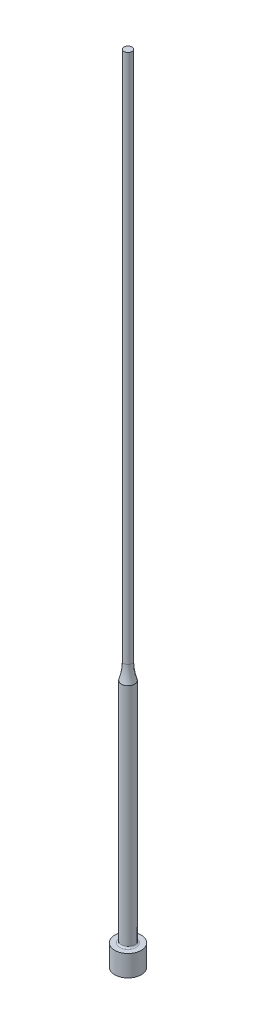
SolidWorks part; units mm, degrees
ref_plane "Front Plane" through (0, 0, 0) normal (0, 0, 1) x (1, 0, 0)
ref_plane "Top Plane" through (0, 0, 0) normal (0, 1, 0) x (1, 0, 0)
ref_plane "Right Plane" through (0, 0, 0) normal (1, 0, 0) x (0, 0, -1)
sketch "Sketch1" plane through (0, 0, 0) normal (0, 0, 1) x (1, 0, 0)
  line L0 (0, 0) -> (2.5, 0)
  line L1 (55, 0) -> (-55, 0) construction
  line L2 (2.5, 0) -> (2.5, 4)
  line L3 (2.5, 4) -> (1.55, 4)
  line L4 (1.25, 4.3) -> (1.25, 46.8775)
  line L6 (0.75, 50) -> (0.75, 150)
  line L7 (0.75, 150) -> (0, 150)
  line L8 (0, 150) -> (0, 0)
  arc A0 (0.75, 50) -> (1.25, 46.8775) centre (10.75, 50) ccw
  arc A1 (1.55, 4) -> (1.25, 4.3) centre (1.55, 4.3) cw
  dimension "D7" = 50
  dimension "D8" = 0.3
  dimension "D5" = 10
  dimension "D1" = 0.75
  dimension "D2" = 1.25
  dimension "D3" = 2.5
  dimension "D4" = 4
  dimension "D6" = 150
revolve "Revolve1" add sketch "Sketch1" angle 360 about L8
